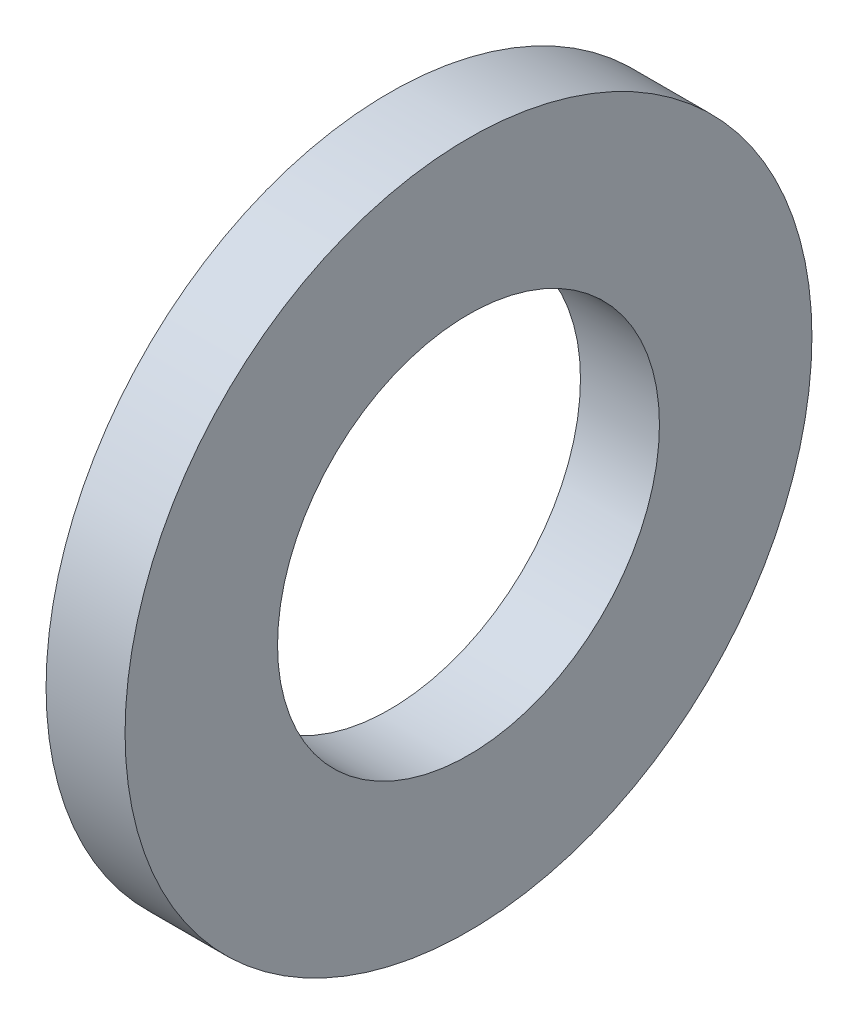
SolidWorks part; units mm, degrees
ref_plane "Plane1" through (0, 0, 0) normal (0, 0, 1) x (1, 0, 0)
ref_plane "Plane2" through (0, 0, 0) normal (0, 1, 0) x (1, 0, 0)
ref_plane "Plane3" through (0, 0, 0) normal (1, 0, 0) x (0, 0, -1)
other "Configuration Table"
sketch "Sketch1" plane through (0, 0, 0) normal (0, 0, 1) x (1, 0, 0)
  line L0 (-34.925, 0) -> (9.525, 0) construction
  line L1 (0, 5.56) -> (0, 10)
  line L2 (0, 10) -> (-2.3, 10)
  line L3 (-2.3, 10) -> (-2.3, 5.56)
  line L4 (-2.3, 5.56) -> (0, 5.56)
  dimension "Thickness" = 2.3
  dimension "Inside_dia" = 11.12
  dimension "Outside_dia" = 20
revolve "Base-Revolve" add sketch "Sketch1" angle 360 about L0
